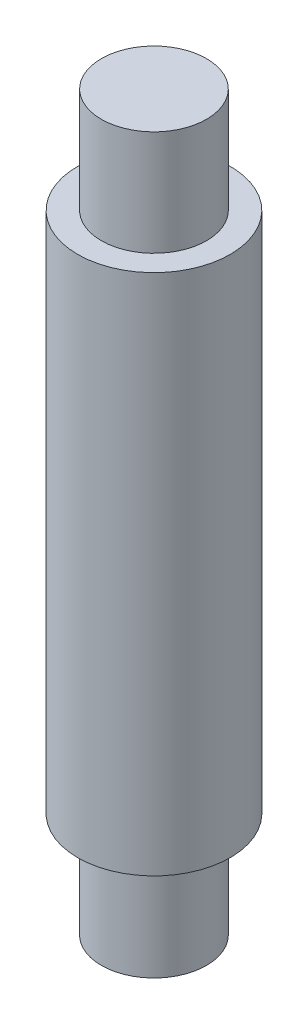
SolidWorks part; units mm, degrees
ref_plane "Front" through (0, 0, 0) normal (0, 0, 1) x (1, 0, 0)
ref_plane "Top" through (0, 0, 0) normal (0, 1, 0) x (1, 0, 0)
ref_plane "Right" through (0, 0, 0) normal (1, 0, 0) x (0, 0, -1)
sketch "Sketch1" plane through (0, 0, 0) normal (0, 0, 1) x (1, 0, 0)
  line L0 (0, 112.0218) -> (0, -110.1517) construction
  line L1 (0, 105.0941) -> (15.0841, 105.0941)
  line L2 (15.0841, 105.0941) -> (15.0841, 74.9259)
  line L3 (15.0841, 74.9259) -> (21.8807, 74.9259)
  line L4 (21.8807, 74.9259) -> (21.8807, -74.9259)
  line L5 (0, 0) -> (21.8807, 0) construction
  line L6 (15.0841, -74.9259) -> (21.8807, -74.9259)
  line L7 (15.0841, -105.0941) -> (15.0841, -74.9259)
  line L8 (0, -105.0941) -> (15.0841, -105.0941)
  line L9 (0, 105.0941) -> (0, -105.0941)
  point P11 (21.8807, 0)
  dimension "D1" = 43.7614
  dimension "D2" = 30.1682
  dimension "D3" = 210.1881
  dimension "D4" = 30.1682
revolve "Revolve1" add sketch "Sketch1" angle 360 about L0
